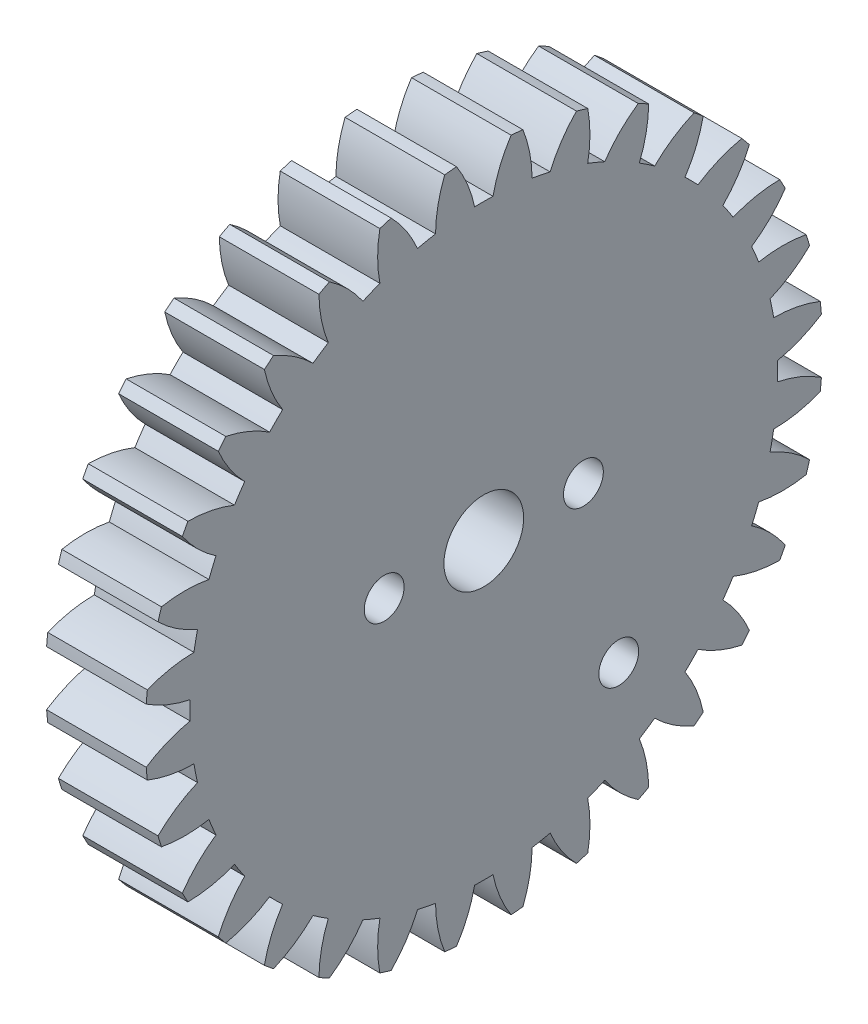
SolidWorks part; units mm, degrees
ref_plane "Front Plane" through (0, 0, 0) normal (0, 0, 1) x (1, 0, 0)
ref_plane "Top Plane" through (0, 0, 0) normal (0, 1, 0) x (1, 0, 0)
ref_plane "Right Plane" through (0, 0, 0) normal (1, 0, 0) x (0, 0, -1)
inserted part "spur gear_am<5>@tmpAssm"
sketch "Sketch1" plane through (-5.7393, 0, 0) normal (1, 0, 0) x (0, 0, -1)
  line L0 (-75.8291, -13.2864) -> (-62.8675, -13.2864) construction
  line L1 (-75.8291, -13.2864) -> (-69.0132, -22.0249) construction
  circle A0 centre (-69.0562, -21.9699) radius 1
  circle A1 centre (-70.8291, -13.2864) radius 1
  circle A2 centre (-80.8291, -13.2864) radius 1
  circle A3 centre (-75.8291, -13.2864) radius 2 construction
  dimension "D2" = 5
  dimension "D3" = 5
  dimension "D4" = 11.0125
  dimension "D1" = 307.954
extrude "Cut-Extrude1" cut sketch "Sketch1" against normal blind 10
sketch "Sketch2" plane through (-5.7393, 0, 0) normal (1, 0, 0) x (0, 0, -1)
  line L0 (-75.8291, -13.2864) -> (-62.1878, -13.2864)
